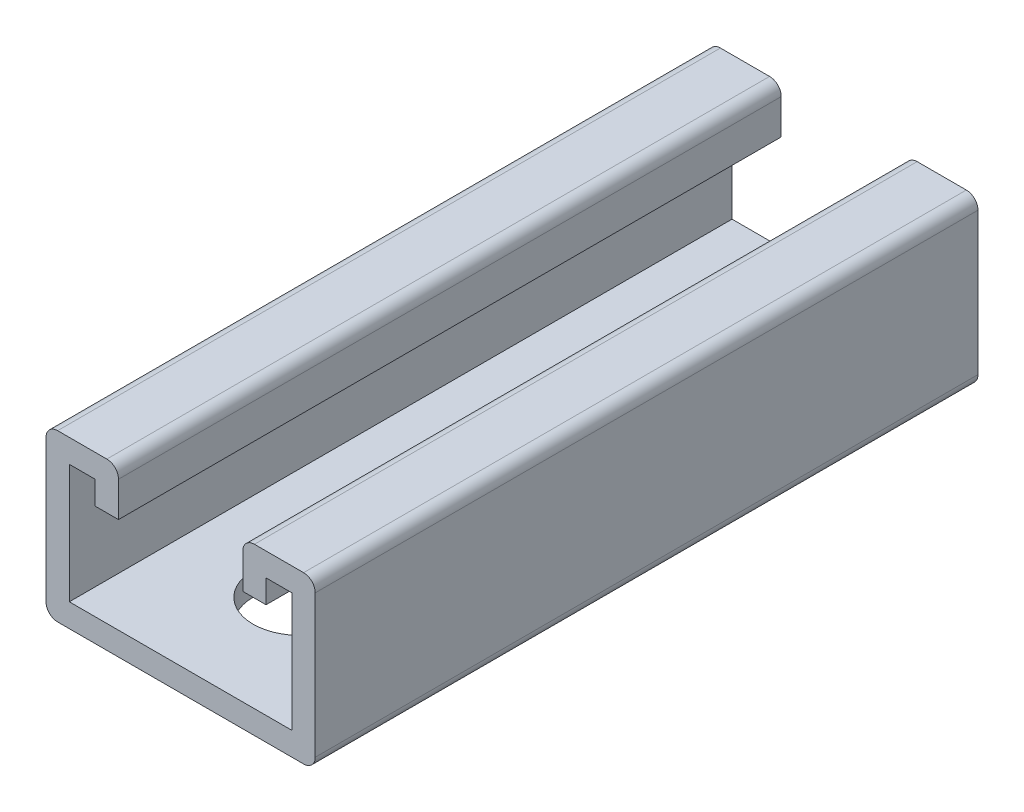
SolidWorks part; units mm, degrees
ref_plane "Plane1" through (0, 0, 0) normal (0, 0, 1) x (1, 0, 0)
ref_plane "Plane2" through (0, 0, 0) normal (0, 1, 0) x (1, 0, 0)
ref_plane "Plane3" through (0, 0, 0) normal (1, 0, 0) x (0, 0, -1)
sketch "Sketch1" plane through (0, 0, 0) normal (0, 0, 1) x (1, 0, 0)
  line L0 (-11.3109, 12.7) -> (-18.8516, 12.7)
  line L1 (-20.6375, 10.9141) -> (-20.6375, -10.9141)
  line L2 (-18.8516, -12.7) -> (18.8516, -12.7)
  line L3 (20.6375, -10.9141) -> (20.6375, 10.9141)
  line L4 (18.8516, 12.7) -> (11.3109, 12.7)
  line L5 (9.525, 10.9141) -> (9.525, 5.5563)
  line L6 (-9.525, 10.9141) -> (-9.525, 5.5563)
  line L7 (-13.0969, 9.1281) -> (-13.0969, 5.5563)
  line L8 (-13.0969, 9.1281) -> (-17.0656, 9.1281)
  line L9 (-17.0656, 9.1281) -> (-17.0656, -9.1281)
  line L10 (-17.0656, -9.1281) -> (17.0656, -9.1281)
  line L11 (17.0656, -9.1281) -> (17.0656, 9.1281)
  line L12 (17.0656, 9.1281) -> (13.0969, 9.1281)
  line L13 (13.0969, 9.1281) -> (13.0969, 5.5563)
  line L14 (-13.0969, 5.5563) -> (-9.525, 5.5563)
  line L15 (9.525, 5.5563) -> (13.0969, 5.5563)
  arc A0 (-11.3109, 12.7) -> (-9.525, 10.9141) centre (-11.3109, 10.9141) cw
  arc A1 (-20.6375, 10.9141) -> (-18.8516, 12.7) centre (-18.8516, 10.9141) cw
  arc A2 (-18.8516, -12.7) -> (-20.6375, -10.9141) centre (-18.8516, -10.9141) cw
  arc A3 (20.6375, -10.9141) -> (18.8516, -12.7) centre (18.8516, -10.9141) cw
  arc A4 (18.8516, 12.7) -> (20.6375, 10.9141) centre (18.8516, 10.9141) cw
  arc A5 (9.525, 10.9141) -> (11.3109, 12.7) centre (11.3109, 10.9141) cw
  dimension "D2" = 1.7859
  dimension "D3" = 20.6375
  dimension "Width" = 41.275
  dimension "D5" = 12.7
  dimension "Height" = 25.4
  dimension "edge" = 11.1125
  dimension "D8" = 19.05
  dimension "ToeHt" = 7.1437
  dimension "gauge" = 3.5719
extrude "Base-Extrude" add sketch "Sketch1" along normal blind 101.6
sketch "Sketch2" plane through (0, -12.7, 0) normal (0, -1, 0) x (1, 0, 0)
  line L0 (7.1437, 32.5438) -> (7.1437, 18.2562)
  line L1 (-7.1437, 18.2562) -> (-7.1437, 32.5438)
  arc A0 (-7.1437, 18.2562) -> (7.1437, 18.2562) centre (0, 18.2562) ccw
  arc A1 (7.1437, 32.5438) -> (-7.1437, 32.5438) centre (0, 32.5438) ccw
  dimension "D3" = 14.2875
  dimension "D1" = 18.2562
  dimension "D2" = 14.2875
extrude "Slot" cut sketch "Sketch2" against normal through all
pattern_linear "LPattern1" count 2 spacing 50.8 along (0, 0, 1) of "Slot"
equation "\"D5@Sketch1\" = \"Height@Sketch1\" / 2"
equation "\"D3@Sketch1\" = \"Width@Sketch1\" / 2"
equation "\"D2@Sketch1\" = \"gauge@Sketch1\" / 2"
equation "\"D8@Sketch1\" = \"Width@Sketch1\" - 2 * \"edge@Sketch1\""
equation "\"gauge@Sketch1\" = \"ToeHt@Sketch1\" / 2"
equation "\"D1@LPattern1\" = \"D1@Base-Extrude\" / \"D3@LPattern1\""
